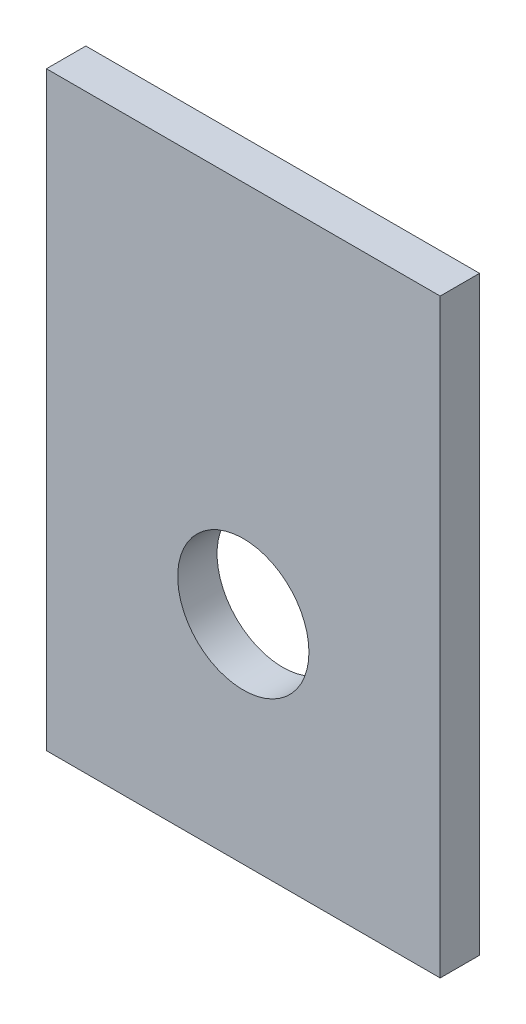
SolidWorks part; units mm, degrees
ref_plane "Plan de face" through (0, 0, 0) normal (0, 0, 1) x (1, 0, 0)
ref_plane "Plan de dessus" through (0, 0, 0) normal (0, 1, 0) x (1, 0, 0)
ref_plane "Plan de droite" through (0, 0, 0) normal (1, 0, 0) x (0, 0, -1)
sketch "Esquisse1" plane through (0, 0, 0) normal (0, 0, 1) x (1, 0, 0)
  line L1 (-30, 40) -> (0, 40)
  line L2 (-30, 40) -> (-30, -5)
  line L3 (-30, -5) -> (0, -5)
  line L4 (0, 40) -> (0, -5)
  dimension "D1" = 30
  dimension "D2" = 45
extrude "Extrusion1" add sketch "Esquisse1" along normal blind 3
sketch "Esquisse2" plane through (0, 0, 3) normal (0, 0, 1) x (1, 0, 0)
  line L0 (-30, -5) -> (0, -5) construction
  line L1 (-30, 40) -> (-30, -5) construction
  circle A0 centre (-15, 11.5) radius 5
  dimension "D1" = 16.5
  dimension "D3" = 10
  dimension "D2" = 15
extrude "Enlèv. mat.-Extru.1" cut sketch "Esquisse2" against normal blind 3
